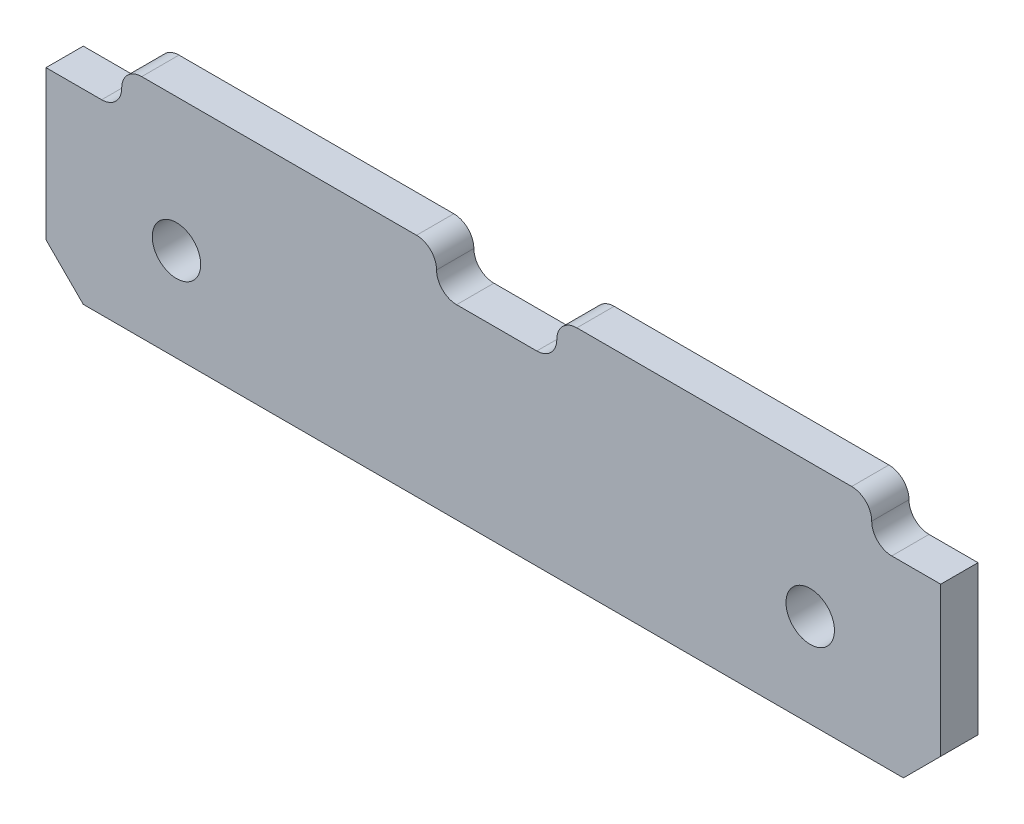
SolidWorks part; units mm, degrees
ref_plane "Plan de face" through (0, 0, 0) normal (0, 0, 1) x (1, 0, 0)
ref_plane "Plan de dessus" through (0, 0, 0) normal (0, 1, 0) x (1, 0, 0)
ref_plane "Plan de droite" through (0, 0, 0) normal (1, 0, 0) x (0, 0, -1)
sketch "Esquisse1" plane through (0, 0, 0) normal (0, 0, 1) x (1, 0, 0)
  line L1 (0, 0) -> (240, 0)
  line L2 (0, 0) -> (0, -50)
  line L3 (0, -50) -> (240, -50)
  line L4 (240, 0) -> (240, -50)
  dimension "D1" = 240
  dimension "D2" = 50
extrude "Boss.-Extru.1" add sketch "Esquisse1" along normal blind 10
sketch "Esquisse2" plane through (0, 0, 0) normal (0, 0, -1) x (-1, 0, 0)
  line L0 (-216.1103, 10.7527) -> (-142.3996, 10.7527) construction
  line L1 (-216.1103, 10.7527) -> (-142.3996, 10.7527)
  line L2 (-99.3888, 10.7527) -> (-25.6781, 10.7527) construction
  line L3 (-99.3888, 10.7527) -> (-25.6781, 10.7527)
  line L4 (0, -50) -> (0, 0)
  line L5 (0, 0) -> (-240, 0)
  line L6 (-240, 0) -> (-240, -50)
  line L7 (-240, -50) -> (0, -50)
  line L9 (-14.9254, 0) -> (-110.1415, 0)
  line L12 (-131.6469, 0) -> (-226.863, 0)
  arc A0 (-137.0232, 5.3763) -> (-131.6469, 0) centre (-131.6469, 5.3763) ccw construction
  arc A1 (-137.0232, 5.3763) -> (-131.6469, 0) centre (-131.6469, 5.3763) ccw
  arc A2 (-137.0232, 5.3763) -> (-142.3996, 10.7527) centre (-142.3996, 5.3763) ccw construction
  arc A3 (-216.1103, 10.7527) -> (-221.4866, 5.3763) centre (-216.1103, 5.3763) ccw construction
  arc A4 (-226.863, 0) -> (-221.4866, 5.3763) centre (-226.863, 5.3763) ccw construction
  arc A5 (-110.1415, 0) -> (-104.7652, 5.3763) centre (-110.1415, 5.3763) ccw construction
  arc A6 (-99.3888, 10.7527) -> (-104.7652, 5.3763) centre (-99.3888, 5.3763) ccw construction
  arc A7 (-20.3018, 5.3763) -> (-25.6781, 10.7527) centre (-25.6781, 5.3763) ccw construction
  arc A8 (-20.3018, 5.3763) -> (-14.9254, 0) centre (-14.9254, 5.3763) ccw construction
  arc A9 (-137.0232, 5.3763) -> (-142.3996, 10.7527) centre (-142.3996, 5.3763) ccw
  arc A10 (-216.1103, 10.7527) -> (-221.4866, 5.3763) centre (-216.1103, 5.3763) ccw
  arc A11 (-226.863, 0) -> (-221.4866, 5.3763) centre (-226.863, 5.3763) ccw
  arc A12 (-110.1415, 0) -> (-104.7652, 5.3763) centre (-110.1415, 5.3763) ccw
  arc A13 (-99.3888, 10.7527) -> (-104.7652, 5.3763) centre (-99.3888, 5.3763) ccw
  arc A14 (-20.3018, 5.3763) -> (-25.6781, 10.7527) centre (-25.6781, 5.3763) ccw
  arc A15 (-20.3018, 5.3763) -> (-14.9254, 0) centre (-14.9254, 5.3763) ccw
  dimension "D1" = 0
extrude "Boss.-Extru.2" add sketch "Esquisse2" against normal blind 10
sketch "Esquisse3" plane through (0, 0, 0) normal (0, 0, -1) x (-1, 0, 0)
  line L0 (0, 0) -> (0, -50) construction
  line L1 (0, -50) -> (-240, -50) construction
  circle A0 centre (-205, -25) radius 6.5
  circle A1 centre (-35, -25) radius 6.5
  dimension "D1" = 13
  dimension "D2" = 13
  dimension "D3" = 170
  dimension "D4" = 35
  dimension "D5" = 25
extrude "Enlèv. mat.-Extru.1" cut sketch "Esquisse3" against normal through all
chamfer "Chanfrein1" distance 10 angle 45 2 edges at (0, -50, 5) (240, -50, 5)
